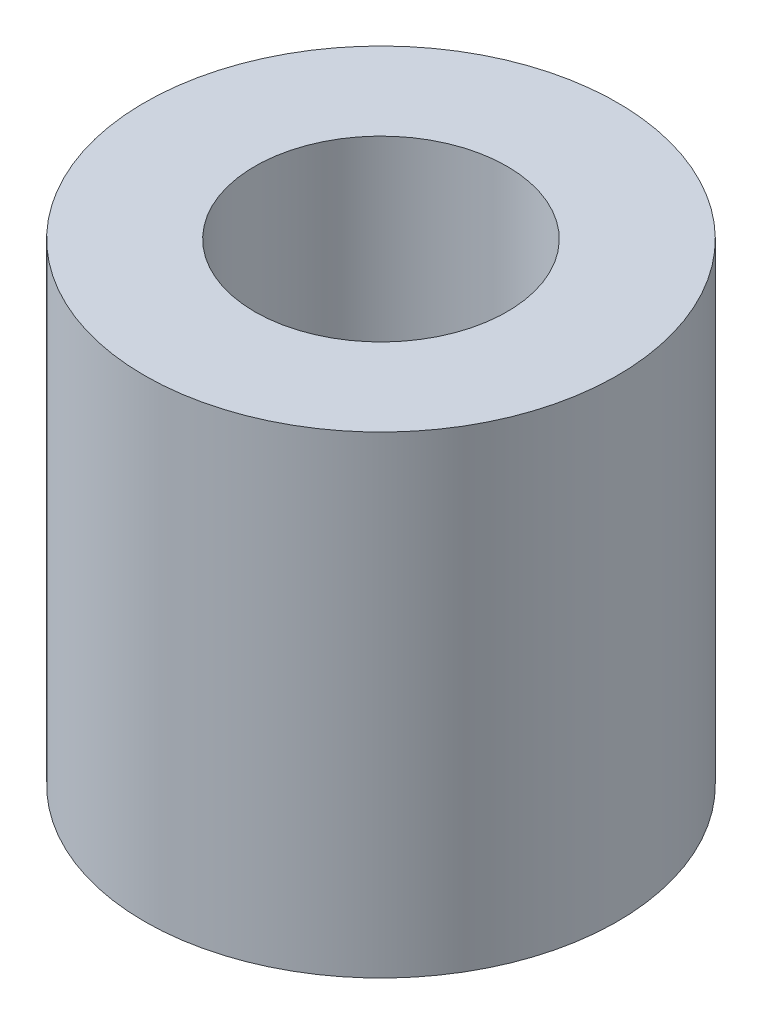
SolidWorks part; units mm, degrees
ref_plane "前视基准面" through (0, 0, 0) normal (0, 0, 1) x (1, 0, 0)
ref_plane "上视基准面" through (0, 0, 0) normal (0, 1, 0) x (1, 0, 0)
ref_plane "右视基准面" through (0, 0, 0) normal (1, 0, 0) x (0, 0, -1)
other "Configuration Table"
sketch "草图1" plane through (0, 0, 0) normal (0, 1, 0) x (1, 0, 0)
  circle A0 centre (0, 0) radius 1.6
  circle A1 centre (0, 0) radius 3
  dimension "D1" = 6
  dimension "D2" = 3.2
extrude "凸台-拉伸1" add sketch "草图1" along normal blind 6
